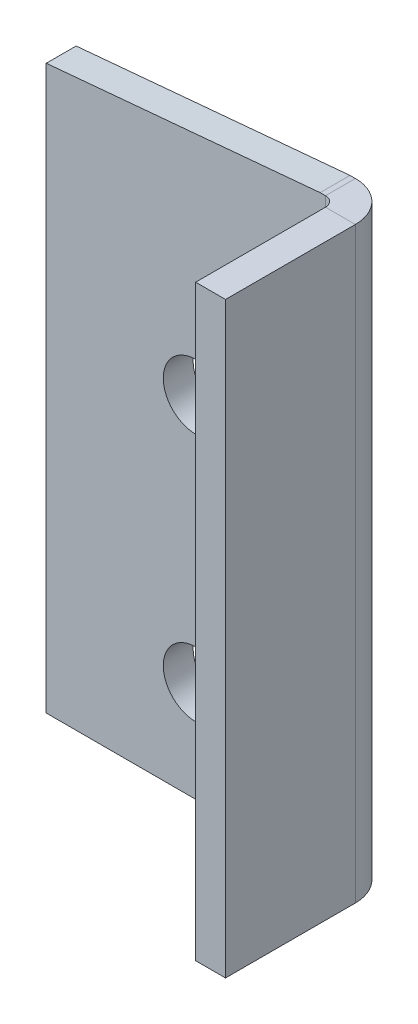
SolidWorks part; units mm, degrees
ref_plane "前视基准面" through (0, 0, 0) normal (0, 0, 1) x (1, 0, 0)
ref_plane "上视基准面" through (0, 0, 0) normal (0, 1, 0) x (1, 0, 0)
ref_plane "右视基准面" through (0, 0, 0) normal (1, 0, 0) x (0, 0, -1)
sketch "草图1" plane through (0, 0, 0) normal (0, 0, 1) x (1, 0, 0)
  line L0 (-35, 118) -> (0, 118)
  line L1 (-90, 0) -> (0, 0)
  line L2 (-90, 0) -> (-90, 113)
  line L3 (-90, 113) -> (-35, 118)
  line L4 (0, 0) -> (0, 118)
  circle A0 centre (-60, 20) radius 6.5
  circle A1 centre (-60, 70) radius 6.5
  dimension "D4" = 13
  dimension "D6" = 30
  dimension "D7" = 30
  dimension "D8" = 50
  dimension "D1" = 90
  dimension "D2" = 35
  dimension "D3" = 113
  dimension "D5" = 20
  dimension "D9" = 118
sheet metal parameters "钣金1" thickness 6 parameters "D1"=2
base flange "基体-法兰1" sketch "草图1" thickness 6 reverse thickness direction yes parameters "D1"=2
sketch "草图2" plane through (0, 0, 0) normal (0, 0, -1) x (-1, 0, 0)
  line L2 (30, 0) -> (30, 118)
  line L3 (30, 0) -> (30, 118)
  dimension "D1" = 30
sketched bend "绘制的折弯1" parameters "D1"=2
bend "草图折弯1" bend radius 2 bend angle 90 parameters "D5"=1
flat pattern "平板型式1"
sketch "折弯-线1" plane through (0, 0, 0) normal (0, 1, 0) x (-1, 0, 0)
bend of the flat pattern "展开-<草图折弯1>1"
